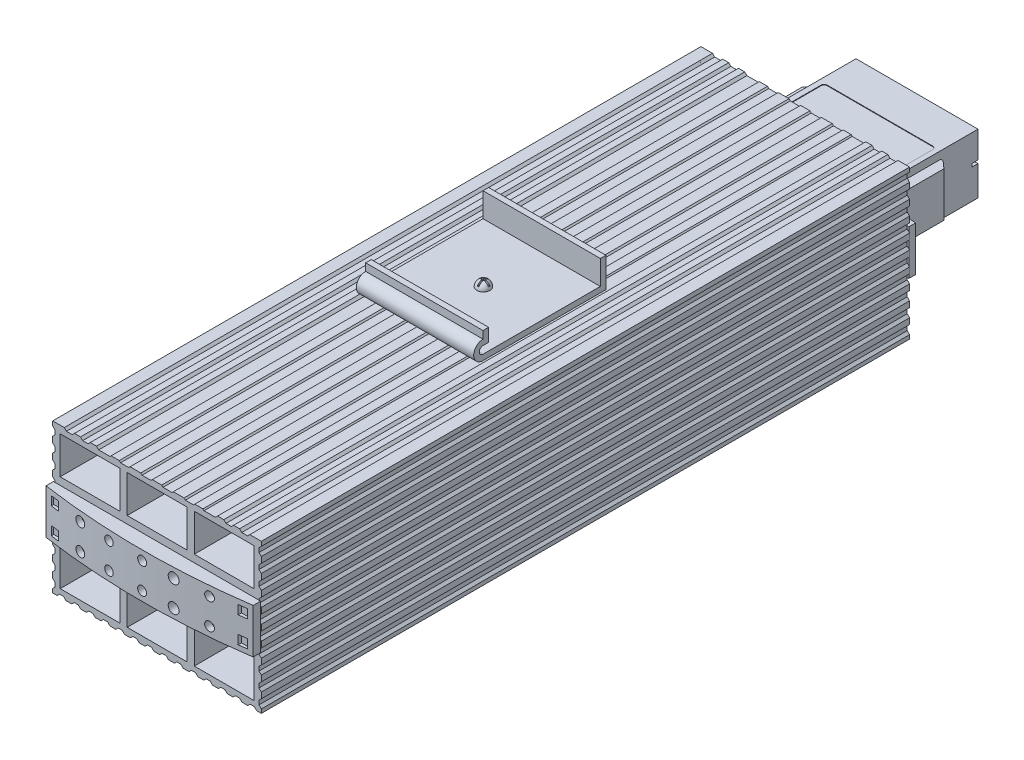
SolidWorks part; units mm, degrees
other "LUMP1"
other "Камера1"
other "Камера2"
ref_plane "Спереди" through (0, 0, 0) normal (0, 0, 1) x (1, 0, 0)
ref_plane "Сверху" through (0, 0, 0) normal (0, 1, 0) x (1, 0, 0)
ref_plane "Справа" through (0, 0, 0) normal (1, 0, 0) x (0, 0, -1)
imported_body "Импортированный1"
sketch "Эскиз1" plane through (0, 0, 220.98) normal (0, 0, 1) x (1, 0, 0)
  line L0 (0, 25.5171) -> (0, 17.6916) construction
  line L1 (-35.56, 23.9) -> (-34.76, 23.1)
  line L2 (-35.56, 25.4) -> (-35.56, -25.4) construction
  line L3 (-34.76, 23.1) -> (-34.76, 21.7)
  line L4 (-34.76, 21.7) -> (-35.56, 20.9)
  line L5 (-35.56, 20.9) -> (-36.3849, 20.9)
  line L6 (-36.3849, 20.9) -> (-36.3849, 23.9)
  line L7 (-36.3849, 23.9) -> (-35.56, 23.9)
  line L8 (35.56, 25.4) -> (-35.56, 25.4) construction
  line L9 (-35.56, 18.9) -> (-34.76, 18.1)
  line L10 (-34.76, 18.1) -> (-34.76, 16.7)
  line L11 (-34.76, 16.7) -> (-35.56, 15.9)
  line L12 (-35.56, 15.9) -> (-36.3849, 15.9)
  line L13 (-36.3849, 15.9) -> (-36.3849, 18.9)
  line L14 (-36.3849, 18.9) -> (-35.56, 18.9)
  line L15 (-35.56, 13.9) -> (-34.76, 13.1)
  line L16 (-34.76, 13.1) -> (-34.76, 11.7)
  line L17 (-34.76, 11.7) -> (-35.56, 10.9)
  line L18 (-35.56, 10.9) -> (-36.3849, 10.9)
  line L19 (-36.3849, 10.9) -> (-36.3849, 13.9)
  line L20 (-36.3849, 13.9) -> (-35.56, 13.9)
  line L21 (-35.56, 8.9) -> (-34.76, 8.1)
  line L22 (-34.76, 8.1) -> (-34.76, 6.7)
  line L23 (-34.76, 6.7) -> (-35.56, 5.9)
  line L24 (-35.56, 5.9) -> (-36.3849, 5.9)
  line L25 (-36.3849, 5.9) -> (-36.3849, 8.9)
  line L26 (-36.3849, 8.9) -> (-35.56, 8.9)
  line L27 (-35.56, 3.9) -> (-34.76, 3.1)
  line L28 (-34.76, 3.1) -> (-34.76, 1.7)
  line L29 (-34.76, 1.7) -> (-35.56, 0.9)
  line L30 (-35.56, 0.9) -> (-36.3849, 0.9)
  line L31 (-36.3849, 0.9) -> (-36.3849, 3.9)
  line L32 (-36.3849, 3.9) -> (-35.56, 3.9)
  line L33 (-35.56, -1.1) -> (-34.76, -1.9)
  line L34 (-34.76, -1.9) -> (-34.76, -3.3)
  line L35 (-34.76, -3.3) -> (-35.56, -4.1)
  line L36 (-35.56, -4.1) -> (-36.3849, -4.1)
  line L37 (-36.3849, -4.1) -> (-36.3849, -1.1)
  line L38 (-36.3849, -1.1) -> (-35.56, -1.1)
  line L39 (-35.56, -6.1) -> (-34.76, -6.9)
  line L40 (-34.76, -6.9) -> (-34.76, -8.3)
  line L41 (-34.76, -8.3) -> (-35.56, -9.1)
  line L42 (-35.56, -9.1) -> (-36.3849, -9.1)
  line L43 (-36.3849, -9.1) -> (-36.3849, -6.1)
  line L44 (-36.3849, -6.1) -> (-35.56, -6.1)
  line L45 (-35.56, -11.1) -> (-34.76, -11.9)
  line L46 (-34.76, -11.9) -> (-34.76, -13.3)
  line L47 (-34.76, -13.3) -> (-35.56, -14.1)
  line L48 (-35.56, -14.1) -> (-36.3849, -14.1)
  line L49 (-36.3849, -14.1) -> (-36.3849, -11.1)
  line L50 (-36.3849, -11.1) -> (-35.56, -11.1)
  line L51 (-35.56, -16.1) -> (-34.76, -16.9)
  line L52 (-34.76, -16.9) -> (-34.76, -18.3)
  line L53 (-34.76, -18.3) -> (-35.56, -19.1)
  line L54 (-35.56, -19.1) -> (-36.3849, -19.1)
  line L55 (-36.3849, -19.1) -> (-36.3849, -16.1)
  line L56 (-36.3849, -16.1) -> (-35.56, -16.1)
  line L57 (-35.56, -21.1) -> (-34.76, -21.9)
  line L58 (-34.76, -21.9) -> (-34.76, -23.3)
  line L59 (-34.76, -23.3) -> (-35.56, -24.1)
  line L60 (-35.56, -24.1) -> (-36.3849, -24.1)
  line L61 (-36.3849, -24.1) -> (-36.3849, -21.1)
  line L62 (-36.3849, -21.1) -> (-35.56, -21.1)
  line L63 (36.3849, -21.1) -> (35.56, -21.1)
  line L64 (36.3849, -24.1) -> (36.3849, -21.1)
  line L65 (35.56, -24.1) -> (36.3849, -24.1)
  line L66 (34.76, -23.3) -> (35.56, -24.1)
  line L67 (34.76, -21.9) -> (34.76, -23.3)
  line L68 (35.56, -21.1) -> (34.76, -21.9)
  line L69 (36.3849, -16.1) -> (35.56, -16.1)
  line L70 (36.3849, -19.1) -> (36.3849, -16.1)
  line L71 (35.56, -19.1) -> (36.3849, -19.1)
  line L72 (34.76, -18.3) -> (35.56, -19.1)
  line L73 (34.76, -16.9) -> (34.76, -18.3)
  line L74 (35.56, -16.1) -> (34.76, -16.9)
  line L75 (36.3849, -11.1) -> (35.56, -11.1)
  line L76 (36.3849, -14.1) -> (36.3849, -11.1)
  line L77 (35.56, -14.1) -> (36.3849, -14.1)
  line L78 (34.76, -13.3) -> (35.56, -14.1)
  line L79 (34.76, -11.9) -> (34.76, -13.3)
  line L80 (35.56, -11.1) -> (34.76, -11.9)
  line L81 (36.3849, -6.1) -> (35.56, -6.1)
  line L82 (36.3849, -9.1) -> (36.3849, -6.1)
  line L83 (35.56, -9.1) -> (36.3849, -9.1)
  line L84 (34.76, -8.3) -> (35.56, -9.1)
  line L85 (34.76, -6.9) -> (34.76, -8.3)
  line L86 (35.56, -6.1) -> (34.76, -6.9)
  line L87 (36.3849, -1.1) -> (35.56, -1.1)
  line L88 (36.3849, -4.1) -> (36.3849, -1.1)
  line L89 (35.56, -4.1) -> (36.3849, -4.1)
  line L90 (34.76, -3.3) -> (35.56, -4.1)
  line L91 (34.76, -1.9) -> (34.76, -3.3)
  line L92 (35.56, -1.1) -> (34.76, -1.9)
  line L93 (36.3849, 3.9) -> (35.56, 3.9)
  line L94 (36.3849, 0.9) -> (36.3849, 3.9)
  line L95 (35.56, 0.9) -> (36.3849, 0.9)
  line L96 (34.76, 1.7) -> (35.56, 0.9)
  line L97 (34.76, 3.1) -> (34.76, 1.7)
  line L98 (35.56, 3.9) -> (34.76, 3.1)
  line L99 (36.3849, 8.9) -> (35.56, 8.9)
  line L100 (36.3849, 5.9) -> (36.3849, 8.9)
  line L101 (35.56, 5.9) -> (36.3849, 5.9)
  line L102 (34.76, 6.7) -> (35.56, 5.9)
  line L103 (34.76, 8.1) -> (34.76, 6.7)
  line L104 (35.56, 8.9) -> (34.76, 8.1)
  line L105 (36.3849, 13.9) -> (35.56, 13.9)
  line L106 (36.3849, 10.9) -> (36.3849, 13.9)
  line L107 (35.56, 10.9) -> (36.3849, 10.9)
  line L108 (34.76, 11.7) -> (35.56, 10.9)
  line L109 (34.76, 13.1) -> (34.76, 11.7)
  line L110 (35.56, 13.9) -> (34.76, 13.1)
  line L111 (36.3849, 18.9) -> (35.56, 18.9)
  line L112 (36.3849, 15.9) -> (36.3849, 18.9)
  line L113 (35.56, 15.9) -> (36.3849, 15.9)
  line L114 (34.76, 16.7) -> (35.56, 15.9)
  line L115 (34.76, 18.1) -> (34.76, 16.7)
  line L116 (35.56, 18.9) -> (34.76, 18.1)
  line L117 (36.3849, 23.9) -> (35.56, 23.9)
  line L118 (36.3849, 20.9) -> (36.3849, 23.9)
  line L119 (35.56, 20.9) -> (36.3849, 20.9)
  line L120 (34.76, 21.7) -> (35.56, 20.9)
  line L121 (34.76, 23.1) -> (34.76, 21.7)
  line L122 (35.56, 23.9) -> (34.76, 23.1)
  dimension "D1" = 3
  dimension "D2" = 1.4
  dimension "D3" = 0.8
  dimension "D4" = 1.5
  dimension "D5" = 10
extrude "Вырез-Вытянуть1" cut sketch "Эскиз1" against normal up to surface (220.98 mm away)
sketch "Эскиз2" plane through (0, 0, 220.98) normal (0, 0, 1) x (1, 0, 0)
  line L0 (-34.06, -25.4) -> (-33.26, -24.6)
  line L1 (-35.56, -25.4) -> (35.56, -25.4) construction
  line L2 (-33.26, -24.6) -> (-31.86, -24.6)
  line L3 (-31.86, -24.6) -> (-31.06, -25.4)
  line L4 (-31.06, -25.4) -> (-31.06, -26.2855)
  line L5 (-31.06, -26.2855) -> (-34.06, -26.2855)
  line L6 (-34.06, -26.2855) -> (-34.06, -25.4)
  line L7 (-29.06, -25.4) -> (-28.26, -24.6)
  line L8 (-28.26, -24.6) -> (-26.86, -24.6)
  line L9 (-26.86, -24.6) -> (-26.06, -25.4)
  line L10 (-26.06, -25.4) -> (-26.06, -26.2855)
  line L11 (-26.06, -26.2855) -> (-29.06, -26.2855)
  line L12 (-29.06, -26.2855) -> (-29.06, -25.4)
  line L13 (-24.06, -25.4) -> (-23.26, -24.6)
  line L14 (-23.26, -24.6) -> (-21.86, -24.6)
  line L15 (-21.86, -24.6) -> (-21.06, -25.4)
  line L16 (-21.06, -25.4) -> (-21.06, -26.2855)
  line L17 (-21.06, -26.2855) -> (-24.06, -26.2855)
  line L18 (-24.06, -26.2855) -> (-24.06, -25.4)
  line L19 (-19.06, -25.4) -> (-18.26, -24.6)
  line L20 (-18.26, -24.6) -> (-16.86, -24.6)
  line L21 (-16.86, -24.6) -> (-16.06, -25.4)
  line L22 (-16.06, -25.4) -> (-16.06, -26.2855)
  line L23 (-16.06, -26.2855) -> (-19.06, -26.2855)
  line L24 (-19.06, -26.2855) -> (-19.06, -25.4)
  line L25 (-14.06, -25.4) -> (-13.26, -24.6)
  line L26 (-13.26, -24.6) -> (-11.86, -24.6)
  line L27 (-11.86, -24.6) -> (-11.06, -25.4)
  line L28 (-11.06, -25.4) -> (-11.06, -26.2855)
  line L29 (-11.06, -26.2855) -> (-14.06, -26.2855)
  line L30 (-14.06, -26.2855) -> (-14.06, -25.4)
  line L31 (-9.06, -25.4) -> (-8.26, -24.6)
  line L32 (-8.26, -24.6) -> (-6.86, -24.6)
  line L33 (-6.86, -24.6) -> (-6.06, -25.4)
  line L34 (-6.06, -25.4) -> (-6.06, -26.2855)
  line L35 (-6.06, -26.2855) -> (-9.06, -26.2855)
  line L36 (-9.06, -26.2855) -> (-9.06, -25.4)
  line L37 (-4.06, -25.4) -> (-3.26, -24.6)
  line L38 (-3.26, -24.6) -> (-1.86, -24.6)
  line L39 (-1.86, -24.6) -> (-1.06, -25.4)
  line L40 (-1.06, -25.4) -> (-1.06, -26.2855)
  line L41 (-1.06, -26.2855) -> (-4.06, -26.2855)
  line L42 (-4.06, -26.2855) -> (-4.06, -25.4)
  line L43 (0.94, -25.4) -> (1.74, -24.6)
  line L44 (1.74, -24.6) -> (3.14, -24.6)
  line L45 (3.14, -24.6) -> (3.94, -25.4)
  line L46 (3.94, -25.4) -> (3.94, -26.2855)
  line L47 (3.94, -26.2855) -> (0.94, -26.2855)
  line L48 (0.94, -26.2855) -> (0.94, -25.4)
  line L49 (5.94, -25.4) -> (6.74, -24.6)
  line L50 (6.74, -24.6) -> (8.14, -24.6)
  line L51 (8.14, -24.6) -> (8.94, -25.4)
  line L52 (8.94, -25.4) -> (8.94, -26.2855)
  line L53 (8.94, -26.2855) -> (5.94, -26.2855)
  line L54 (5.94, -26.2855) -> (5.94, -25.4)
  line L55 (10.94, -25.4) -> (11.74, -24.6)
  line L56 (11.74, -24.6) -> (13.14, -24.6)
  line L57 (13.14, -24.6) -> (13.94, -25.4)
  line L58 (13.94, -25.4) -> (13.94, -26.2855)
  line L59 (13.94, -26.2855) -> (10.94, -26.2855)
  line L60 (10.94, -26.2855) -> (10.94, -25.4)
  line L61 (15.94, -25.4) -> (16.74, -24.6)
  line L62 (16.74, -24.6) -> (18.14, -24.6)
  line L63 (18.14, -24.6) -> (18.94, -25.4)
  line L64 (18.94, -25.4) -> (18.94, -26.2855)
  line L65 (18.94, -26.2855) -> (15.94, -26.2855)
  line L66 (15.94, -26.2855) -> (15.94, -25.4)
  line L67 (20.94, -25.4) -> (21.74, -24.6)
  line L68 (21.74, -24.6) -> (23.14, -24.6)
  line L69 (23.14, -24.6) -> (23.94, -25.4)
  line L70 (23.94, -25.4) -> (23.94, -26.2855)
  line L71 (23.94, -26.2855) -> (20.94, -26.2855)
  line L72 (20.94, -26.2855) -> (20.94, -25.4)
  line L73 (25.94, -25.4) -> (26.74, -24.6)
  line L74 (26.74, -24.6) -> (28.14, -24.6)
  line L75 (28.14, -24.6) -> (28.94, -25.4)
  line L76 (28.94, -25.4) -> (28.94, -26.2855)
  line L77 (28.94, -26.2855) -> (25.94, -26.2855)
  line L78 (25.94, -26.2855) -> (25.94, -25.4)
  line L79 (30.94, -25.4) -> (31.74, -24.6)
  line L80 (31.74, -24.6) -> (33.14, -24.6)
  line L81 (33.14, -24.6) -> (33.94, -25.4)
  line L82 (33.94, -25.4) -> (33.94, -26.2855)
  line L83 (33.94, -26.2855) -> (30.94, -26.2855)
  line L84 (30.94, -26.2855) -> (30.94, -25.4)
  dimension "D1" = 3
  dimension "D2" = 1.4
  dimension "D3" = 0.8
  dimension "D5" = 1.5
  dimension "D4" = 14
extrude "Вырез-Вытянуть2" cut sketch "Эскиз2" against normal up to surface (220.98 mm away)
sketch "Эскиз3" plane through (0, 0, 220.98) normal (0, 0, 1) x (1, 0, 0)
  line L0 (-31.616, 25.4) -> (-30.8814, 24.6654)
  line L1 (35.56, 25.4) -> (-35.56, 25.4) construction
  line L2 (-30.8814, 24.6654) -> (-28.8881, 24.6654)
  line L3 (-28.8881, 24.6654) -> (-28.1535, 25.4)
  line L4 (-28.1535, 25.4) -> (-26.0902, 25.4)
  line L5 (-26.0902, 25.4) -> (-25.3556, 24.6654)
  line L6 (-25.3556, 24.6654) -> (-23.5022, 24.6654)
  line L7 (-23.5022, 24.6654) -> (-22.7675, 25.4)
  line L8 (-22.7675, 25.4) -> (-20.6343, 25.4)
  line L9 (-20.6343, 25.4) -> (-19.8997, 24.6654)
  line L10 (-19.8997, 24.6654) -> (-16.019, 24.6654)
  line L11 (-16.019, 24.6654) -> (-15.6517, 25.0327)
  line L12 (-15.6517, 25.0327) -> (-12.8703, 25.0327)
  line L13 (-12.8703, 25.0327) -> (-12.4264, 24.5887)
  line L14 (-12.4264, 24.5887) -> (-9.6429, 24.5887)
  line L15 (-9.6429, 24.5887) -> (-9.199, 25.0327)
  line L16 (-9.199, 25.0327) -> (-5.5496, 25.0327)
  line L17 (-5.5496, 25.0327) -> (-5.1057, 24.5887)
  line L18 (-5.1057, 24.5887) -> (-2.0467, 24.5887)
  line L19 (0, 25.4) -> (0, 20.2876) construction
  line L20 (-2.0467, 24.5887) -> (-1.6027, 25.0327)
  line L21 (-1.6027, 25.0327) -> (1.6027, 25.0327)
  line L22 (2.0467, 24.5887) -> (1.6027, 25.0327)
  line L23 (5.1057, 24.5887) -> (2.0467, 24.5887)
  line L24 (5.5496, 25.0327) -> (5.1057, 24.5887)
  line L25 (9.199, 25.0327) -> (5.5496, 25.0327)
  line L26 (9.6429, 24.5887) -> (9.199, 25.0327)
  line L27 (12.4264, 24.5887) -> (9.6429, 24.5887)
  line L28 (12.8703, 25.0327) -> (12.4264, 24.5887)
  line L29 (15.6517, 25.0327) -> (12.8703, 25.0327)
  line L30 (16.019, 24.6654) -> (15.6517, 25.0327)
  line L31 (19.8997, 24.6654) -> (16.019, 24.6654)
  line L32 (20.6343, 25.4) -> (19.8997, 24.6654)
  line L33 (22.7675, 25.4) -> (20.6343, 25.4)
  line L34 (23.5022, 24.6654) -> (22.7675, 25.4)
  line L35 (25.3556, 24.6654) -> (23.5022, 24.6654)
  line L36 (26.0902, 25.4) -> (25.3556, 24.6654)
  line L37 (28.1535, 25.4) -> (26.0902, 25.4)
  line L38 (28.8881, 24.6654) -> (28.1535, 25.4)
  line L39 (30.8814, 24.6654) -> (28.8881, 24.6654)
  line L40 (31.616, 25.4) -> (30.8814, 24.6654)
  line L41 (-31.616, 25.4) -> (-31.616, 26.1571)
  line L42 (-31.616, 26.1571) -> (-20.0025, 26.1571)
  line L43 (-20.0025, 31.75) -> (-20.0025, 25.4) construction
  line L44 (-20.0025, 26.1571) -> (-20.0025, 25.4)
  line L45 (-20.0025, 25.4) -> (20.0025, 25.4)
  line L46 (20.0025, 25.4) -> (20.0025, 31.75) construction
  line L47 (20.0025, 25.4) -> (20.0025, 26.1571)
  line L48 (20.0025, 26.1571) -> (31.616, 26.1571)
  line L49 (31.616, 26.1571) -> (31.616, 25.4)
  point P27 (0, 25.0327)
extrude "Вырез-Вытянуть3" cut sketch "Эскиз3" against normal up to surface (220.98 mm away)
sketch "Эскиз4" plane through (0, -10.16, 0) normal (0, -1, 0) x (1, 0, 0)
  line L0 (-18.5499, -8.4033) -> (-18.5499, -35.8686)
  line L1 (-18.5499, -35.8686) -> (-6.5617, -35.8686)
  line L2 (-6.5617, -35.8686) -> (-6.5617, -8.4033)
  line L3 (-6.5617, -8.4033) -> (-5.9617, -8.4033)
  line L4 (-5.9617, -8.4033) -> (-5.9617, -35.8686)
  line L5 (-5.9617, -35.8686) -> (6.0266, -35.8686)
  line L6 (6.0266, -35.8686) -> (6.0266, -8.4033)
  line L7 (6.0266, -8.4033) -> (6.6266, -8.4033)
  line L8 (6.6266, -8.4033) -> (6.6266, -35.8686)
  line L9 (6.6266, -35.8686) -> (18.5448, -35.8686)
  line L10 (18.5448, -35.8686) -> (18.5448, -8.4033)
  line L11 (18.5448, -8.4033) -> (19.1448, -8.4033)
  line L12 (19.1448, -8.4033) -> (19.1448, -36.2918)
  line L13 (19.1448, -36.2918) -> (-19.1499, -36.2918)
  line L14 (-19.1499, -36.2918) -> (-19.1499, -8.4033)
  line L15 (-19.1499, -8.4033) -> (-18.5499, -8.4033)
  line L17 (-18.2499, -35.56) -> (-18.2499, -30.48) construction
  line L18 (-5.6617, -35.56) -> (-5.6617, -30.48) construction
  line L19 (6.9266, -35.56) -> (6.9266, -30.48) construction
  line L20 (18.2448, -35.56) -> (18.2448, -30.48) construction
  dimension "D1" = 0.6
  dimension "D2" = 0.3
  dimension "D3" = 0.6
  dimension "D4" = 0.3
  dimension "D5" = 0.6
  dimension "D6" = 0.3
  dimension "D7" = 0.6
  dimension "D8" = 0.3
extrude "Вырез-Вытянуть4" cut sketch "Эскиз4" against normal blind 2
sketch "Эскиз5" plane through (0, -11.684, 0) normal (0, -1, 0) x (1, 0, 0)
  circle A0 centre (-12.5908, -33.02) radius 2.0359
extrude "Вырез-Вытянуть5" cut sketch "Эскиз5" against normal blind 0.5
sketch "Эскиз6" plane through (0, -11.184, 0) normal (0, -1, 0) x (1, 0, 0)
  line L0 (-12.5908, -30.9841) -> (-12.5908, -35.1828) construction
  line L1 (-12.4708, -32.4716) -> (-11.0908, -32.4716)
  line L2 (-13.8908, -33.1116) -> (-11.2908, -33.1116)
  line L3 (-13.8908, -33.1116) -> (-13.8908, -33.3516)
  line L4 (-13.8908, -33.3516) -> (-11.2908, -33.3516)
  line L5 (-11.2908, -33.1116) -> (-11.2908, -33.3516)
  line L6 (-13.5908, -33.7516) -> (-11.5908, -33.7516)
  line L7 (-13.5908, -33.7516) -> (-13.5908, -33.9916)
  line L8 (-13.5908, -33.9916) -> (-11.5908, -33.9916)
  line L9 (-11.5908, -33.7516) -> (-11.5908, -33.9916)
  line L10 (-14.0908, -32.4716) -> (-12.7108, -32.4716)
  line L11 (-14.0908, -32.4716) -> (-14.0908, -32.7116)
  line L12 (-14.0908, -32.7116) -> (-11.0908, -32.7116)
  line L13 (-11.0908, -32.4716) -> (-11.0908, -32.7116)
  line L14 (-12.7108, -31.253) -> (-12.4708, -31.253)
  line L15 (-12.7108, -31.253) -> (-12.7108, -32.4716)
  line L17 (-12.4708, -31.253) -> (-12.4708, -32.4716)
  circle A0 centre (-12.5908, -33.02) radius 2.0359 construction
  circle A1 centre (-12.5908, -33.02) radius 2.0359 construction
  dimension "D1" = 0.24
  dimension "D2" = 0.12
  dimension "D3" = 0.24
  dimension "D4" = 0.24
  dimension "D5" = 1.5
  dimension "D6" = 3
  dimension "D7" = 2.6
  dimension "D8" = 0.24
  dimension "D9" = 1.3
  dimension "D10" = 0.24
  dimension "D11" = 1
  dimension "D12" = 2
  dimension "D13" = 0.4
  dimension "D14" = 0.4
extrude "Бобышка-Вытянуть1" add sketch "Эскиз6" along normal blind 0.6
sketch "Эскиз7" plane through (0, -11.684, 0) normal (0, -1, 0) x (1, 0, 0)
  circle A0 centre (-0.0025, -33.02) radius 2.033
extrude "Вырез-Вытянуть6" cut sketch "Эскиз7" against normal blind 0.5
sketch "Эскиз8" plane through (0, -11.184, 0) normal (0, -1, 0) x (1, 0, 0)
  line L0 (-0.3942, -31.3886) -> (-0.3942, -34.0055)
  line L1 (-0.3942, -34.0055) -> (1.3481, -34.0055)
  line L2 (1.3481, -34.0055) -> (1.3481, -34.2455)
  line L3 (1.3481, -34.2455) -> (-0.6342, -34.2455)
  line L4 (-0.6342, -34.2455) -> (-0.6342, -31.3886)
  line L5 (-0.6342, -31.3886) -> (-0.3942, -31.3886)
  dimension "D1" = 0.24
  dimension "D2" = 0.24
extrude "Бобышка-Вытянуть2" add sketch "Эскиз8" along normal blind 0.6
sketch "Эскиз9" plane through (0, -11.684, 0) normal (0, -1, 0) x (1, 0, 0)
  circle A0 centre (12.5857, -33.02) radius 2.0678
extrude "Вырез-Вытянуть7" cut sketch "Эскиз9" against normal blind 0.5
sketch "Эскиз10" plane through (0, -11.184, 0) normal (0, -1, 0) x (1, 0, 0)
  line L0 (13.5349, -31.5862) -> (13.5349, -34.1127)
  line L1 (13.5349, -34.1127) -> (11.64, -31.5862)
  line L2 (11.64, -31.5862) -> (11.4, -31.5862)
  line L3 (11.4, -31.5862) -> (11.4, -34.4665)
  line L4 (11.4, -34.4665) -> (11.64, -34.4665)
  line L5 (11.64, -34.4665) -> (11.64, -31.9399)
  line L6 (11.64, -31.9399) -> (13.5349, -34.4665)
  line L7 (13.5349, -34.4665) -> (13.7749, -34.4665)
  line L8 (13.7749, -34.4665) -> (13.7749, -31.5862)
  line L9 (13.7749, -31.5862) -> (13.5349, -31.5862)
  dimension "D1" = 0.24
  dimension "D2" = 0.24
extrude "Бобышка-Вытянуть3" add sketch "Эскиз10" along normal blind 0.6
sketch "Эскиз11" plane through (0, 0, -38.1) normal (0, 0, -1) x (-1, 0, 0)
  line L0 (-20.7892, -10.16) -> (-20.7892, 10.16) construction
  line L1 (-20.7892, 1.0581) -> (20.7892, 1.0581)
  line L2 (-20.7892, 1.0581) -> (-20.7892, 0)
  line L3 (-20.7892, 0) -> (20.7892, 0)
  line L4 (20.7892, 1.0581) -> (20.7892, 0)
  line L5 (20.7892, 10.16) -> (20.7892, -10.16) construction
extrude "Вырез-Вытянуть8" cut sketch "Эскиз11" against normal blind 2
ref_plane "Плоскость1" through (0, 0, 226.98) normal (0, 0, 1) x (1, 0, 0)
sketch "Эскиз12" plane through (0, 0, 226.98) normal (0, 0, 1) x (1, 0, 0)
  line L0 (0, 0) -> (7.9044, 0) construction
  line L1 (-33.2126, 5.9484) -> (-30.3739, 5.9484)
  line L2 (-33.2126, 5.9484) -> (-33.2126, 2.8969)
  line L3 (-33.2126, 2.8969) -> (-30.3739, 2.8969)
  line L4 (-30.3739, 5.9484) -> (-30.3739, 2.8969)
  line L5 (33.6384, 5.9484) -> (30.7997, 5.9484)
  line L6 (33.6384, 5.9484) -> (33.6384, 2.8969)
  line L7 (33.6384, 2.8969) -> (30.7997, 2.8969)
  line L8 (30.7997, 5.9484) -> (30.7997, 2.8969)
  line L9 (30.7997, -5.9484) -> (30.7997, -2.8969)
  line L10 (33.6384, -2.8969) -> (30.7997, -2.8969)
  line L11 (33.6384, -5.9484) -> (33.6384, -2.8969)
  line L12 (33.6384, -5.9484) -> (30.7997, -5.9484)
  line L13 (-30.3739, -5.9484) -> (-30.3739, -2.8969)
  line L14 (-33.2126, -2.8969) -> (-30.3739, -2.8969)
  line L15 (-33.2126, -5.9484) -> (-33.2126, -2.8969)
  line L16 (-33.2126, -5.9484) -> (-30.3739, -5.9484)
  circle A0 centre (-22.0829, 4.4227) radius 1.6541
  circle A1 centre (-11.5711, 4.4227) radius 1.5258
  circle A2 centre (0, 4.4227) radius 1.5258
  circle A3 centre (10.512, 4.4227) radius 1.7797
  circle A4 centre (22.0017, 4.4227) radius 1.5258
  circle A5 centre (22.0017, -4.4227) radius 1.5258
  circle A6 centre (10.512, -4.4227) radius 1.7797
  circle A7 centre (0, -4.4227) radius 1.5258
  circle A8 centre (-11.5711, -4.4227) radius 1.5258
  circle A9 centre (-22.0829, -4.4227) radius 1.6541
extrude "Вырез-Вытянуть9" cut sketch "Эскиз12" against normal blind 4
ref_plane "Плоскость2" through (0, 0, -5) normal (0, 0, -1) x (-1, 0, 0)
sketch "Эскиз13" plane through (0, 0, -5) normal (0, 0, -1) x (-1, 0, 0)
  line L1 (-32.5253, 6.2342) -> (-29.8673, 6.2342)
  line L2 (-32.5253, 6.2342) -> (-32.5253, 3.5762)
  line L3 (-32.5253, 3.5762) -> (-29.8673, 3.5762)
  line L4 (-29.8673, 6.2342) -> (-29.8673, 3.5762)
  line L5 (33.5046, 6.2342) -> (30.9865, 6.2342)
  line L6 (33.5046, 6.2342) -> (33.5046, 3.5762)
  line L7 (33.5046, 3.5762) -> (30.9865, 3.5762)
  line L8 (30.9865, 6.2342) -> (30.9865, 3.5762)
  line L9 (33.5046, -6.0065) -> (30.9865, -6.0065)
  line L10 (33.5046, -6.0065) -> (33.5046, -2.9988)
  line L11 (33.5046, -2.9988) -> (30.9865, -2.9988)
  line L12 (30.9865, -6.0065) -> (30.9865, -2.9988)
  line L13 (-32.5253, -6.0065) -> (-29.8673, -6.0065)
  line L14 (-32.5253, -6.0065) -> (-32.5253, -2.9988)
  line L15 (-32.5253, -2.9988) -> (-29.8673, -2.9988)
  line L16 (-29.8673, -6.0065) -> (-29.8673, -2.9988)
extrude "Вырез-Вытянуть10" cut sketch "Эскиз13" against normal blind 4
sketch "Эскиз14" plane through (0, 27.305, 0) normal (0, 1, 0) x (1, 0, 0)
  line L0 (20.0025, -109.855) -> (-19.7606, -109.855) construction
  line L1 (20.0025, -129.8575) -> (20.0025, -89.8525) construction
  line L2 (2.3713, -109.855) -> (-2.0951, -109.855)
  arc A0 (2.3713, -109.855) -> (-2.0951, -109.855) centre (0.1381, -109.855) cw
revolve "Повернуть1" add sketch "Эскиз14" angle 180 about L0
ref_plane "Плоскость3" through (0, 32.305, 0) normal (0, 1, 0) x (1, 0, 0)
sketch "Эскиз15" plane through (0, 32.305, 0) normal (0, 1, 0) x (1, 0, 0)
  line L0 (0.25, -107.6246) -> (0.25, -112.0854) construction
  line L1 (-2.0951, -109.855) -> (2.3713, -109.855) construction
  line L2 (0, -107.905) -> (0.5, -107.905)
  line L3 (0.5, -107.905) -> (0.5, -109.605)
  line L4 (0.5, -109.605) -> (2.2, -109.605)
  line L5 (2.2, -109.605) -> (2.2, -110.105)
  line L6 (2.2, -110.105) -> (0.5, -110.105)
  line L7 (0.5, -110.105) -> (0.5, -111.805)
  line L8 (0.5, -111.805) -> (0, -111.805)
  line L9 (0, -111.805) -> (0, -110.105)
  line L10 (0, -110.105) -> (-1.7, -110.105)
  line L11 (-1.7, -110.105) -> (-1.7, -109.605)
  line L12 (-1.7, -109.605) -> (0, -109.605)
  line L13 (0, -109.605) -> (0, -107.905)
  circle A0 centre (0.1381, -109.855) radius 2.2332 construction
  dimension "D1" = 0.25
  dimension "D2" = 0.25
  dimension "D3" = 0.25
  dimension "D4" = 0.25
  dimension "D5" = 0.25
  dimension "D6" = 0.25
  dimension "D7" = 0.25
  dimension "D8" = 0.25
  dimension "D9" = 1.7
  dimension "D10" = 1.7
  dimension "D11" = 1.7
  dimension "D12" = 1.7
extrude "Вырез-Вытянуть11" cut sketch "Эскиз15" against normal blind 4
sketch "Эскиз16" plane through (0, 10.16, 0) normal (0, 1, 0) x (1, 0, 0)
  line L1 (18.1162, 7.4086) -> (-17.9643, 7.4086)
  line L2 (19.1162, 8.4086) -> (19.1162, 24.4033)
  line L3 (18.1162, 25.4033) -> (-17.9643, 25.4033)
  line L4 (-18.9643, 8.4086) -> (-18.9643, 24.4033)
  line L5 (19.1162, 7.4086) -> (-18.9643, 25.4033) construction
  line L6 (19.1162, 25.4033) -> (-18.9643, 7.4086) construction
  arc A0 (-17.9643, 7.4086) -> (-18.9643, 8.4086) centre (-17.9643, 8.4086) cw
  arc A1 (-17.9643, 25.4033) -> (-18.9643, 24.4033) centre (-17.9643, 24.4033) ccw
  arc A2 (19.1162, 24.4033) -> (18.1162, 25.4033) centre (18.1162, 24.4033) ccw
  arc A3 (18.1162, 7.4086) -> (19.1162, 8.4086) centre (18.1162, 8.4086) ccw
  point P4 (0.0759, 16.406)
  dimension "D1" = 1
sketch "Эскиз17" plane through (0, 10.16, 0) normal (0, 1, 0) x (1, 0, 0)
  line L0 (18.1162, 7.4086) -> (-17.9643, 7.4086)
  line L1 (19.1162, 8.4086) -> (19.1162, 24.4033)
  line L2 (18.1162, 25.4033) -> (-17.9643, 25.4033)
  line L3 (-18.9643, 8.4086) -> (-18.9643, 24.4033)
  line L4 (19.1162, 7.4086) -> (-18.9643, 25.4033) construction
  line L5 (19.1162, 25.4033) -> (-18.9643, 7.4086) construction
  arc A0 (-17.9643, 7.4086) -> (-18.9643, 8.4086) centre (-17.9643, 8.4086) cw
  arc A1 (-17.9643, 25.4033) -> (-18.9643, 24.4033) centre (-17.9643, 24.4033) ccw
  arc A2 (19.1162, 24.4033) -> (18.1162, 25.4033) centre (18.1162, 24.4033) ccw
  arc A3 (18.1162, 7.4086) -> (19.1162, 8.4086) centre (18.1162, 8.4086) ccw
  point P4 (0.0759, 16.406)
  dimension "D1" = 1
extrude "Вырез-Вытянуть12" cut sketch "Эскиз17" against normal blind 0.2
